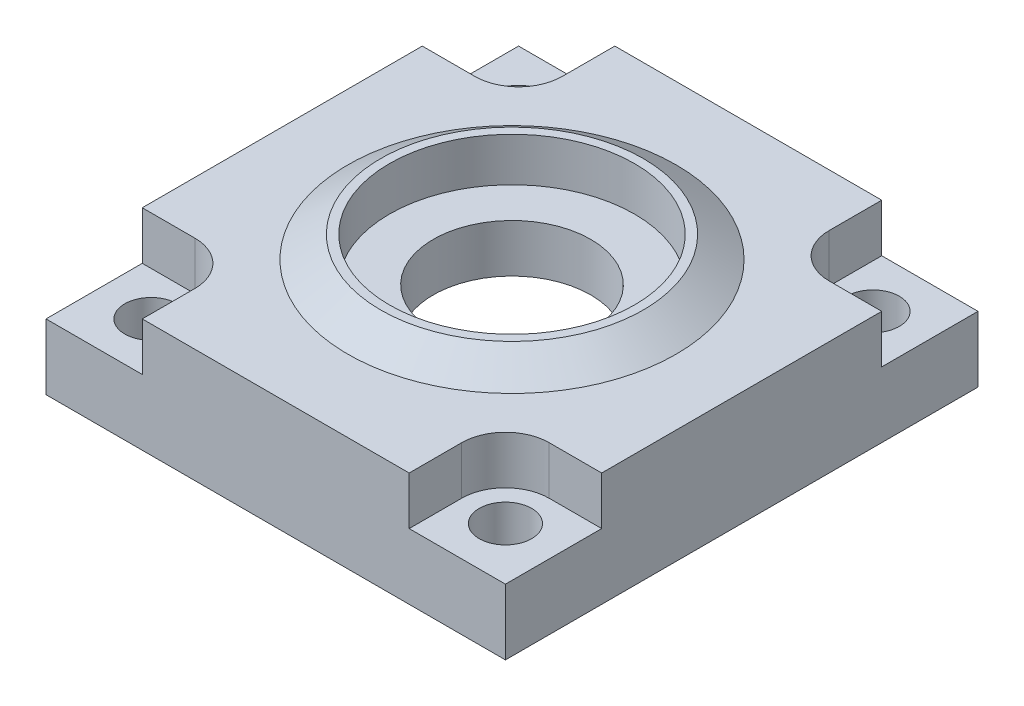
SolidWorks part; units mm, degrees
ref_plane "Face" through (0, 0, 0) normal (0, 0, 1) x (1, 0, 0)
ref_plane "Dessus" through (0, 0, 0) normal (0, 1, 0) x (1, 0, 0)
ref_plane "Droite" through (0, 0, 0) normal (1, 0, 0) x (0, 0, -1)
sketch "Esquisse1" plane through (0, 0, 0) normal (0, 0, 1) x (1, 0, 0)
  line L1 (-26.25, 13) -> (26.25, 13)
  line L2 (-26.25, 13) -> (-26.25, 0)
  line L3 (-26.25, 0) -> (26.25, 0)
  line L4 (26.25, 13) -> (26.25, 0)
  dimension "D1" = 52.5
  dimension "D2" = 13
extrude "Extrusion1" add sketch "Esquisse1" along normal mid plane 54
sketch "Esquisse2" plane through (0, 0, 0) normal (0, 0, 1) x (1, 0, 0)
  line L0 (0, 0) -> (0, 21.6174) construction
  line L1 (0, 13) -> (-18.75, 13)
  line L2 (-18.75, 13) -> (-15, 15.5)
  line L3 (-15, 15.5) -> (0, 15.5)
  line L4 (0, 15.5) -> (0, 13)
  line L5 (26.25, 13) -> (-26.25, 13) construction
  dimension "D1" = 2.5
  dimension "D2" = 30
  dimension "D3" = 37.5
revolve "Révolution1" add sketch "Esquisse2" angle 360 about L0
sketch "Esquisse3" plane through (0, 15.5, 0) normal (0, 1, 0) x (-1, 0, 0)
  circle A0 centre (0, 0) radius 14
  dimension "D1" = 28
extrude "Enlèv. mat.-Extru.1" cut sketch "Esquisse3" against normal blind 5
sketch "Esquisse4" plane through (0, 0, 0) normal (0, 1, 0) x (-1, 0, 0)
  circle A0 centre (0, 0) radius 18.5
  dimension "D1" = 37
extrude "Enlèv. mat.-Extru.3" cut sketch "Esquisse4" along normal blind 5
sketch "Esquisse5" plane through (0, 10.5, 0) normal (0, 1, 0) x (-1, 0, 0)
  circle A0 centre (0, 0) radius 9
  dimension "D1" = 18
extrude "Enlèv. mat.-Extru.4" cut sketch "Esquisse5" against normal through all
sketch "Esquisse6" plane through (0, 13, 0) normal (0, 1, 0) x (-1, 0, 0)
  line L1 (-26.25, 16) -> (-15.25, 16)
  line L2 (-26.25, 16) -> (-26.25, 27)
  line L3 (-26.25, 27) -> (-15.25, 27)
  line L4 (-15.25, 16) -> (-15.25, 27)
  dimension "D1" = 11
extrude "Enlèv. mat.-Extru.5" cut sketch "Esquisse6" against normal blind 5.5
fillet "Congé1" radius 5 1 edges at (15.25, 10.25, 16)
sketch "Esquisse7" plane through (0, 7.5, 0) normal (0, 1, 0) x (-1, 0, 0)
  line L1 (-26.25, 27) -> (-26.25, 16) construction
  line L2 (-15.25, 27) -> (-26.25, 27) construction
  circle A0 centre (-20.25, 21) radius 3
  dimension "D1" = 6
  dimension "D2" = 6
  dimension "D3" = 6
extrude "Enlèv. mat.-Extru.6" cut sketch "Esquisse7" against normal through all
mirror "Symétrie2" about plane through (0, 0, 0) normal (0, 0, 1) of "Enlèv. mat.-Extru.6", "Congé1", "Enlèv. mat.-Extru.5"
mirror "Symétrie3" about plane through (0, 0, 0) normal (1, 0, 0) of "Enlèv. mat.-Extru.6", "Congé1", "Enlèv. mat.-Extru.5", "Symétrie2"
